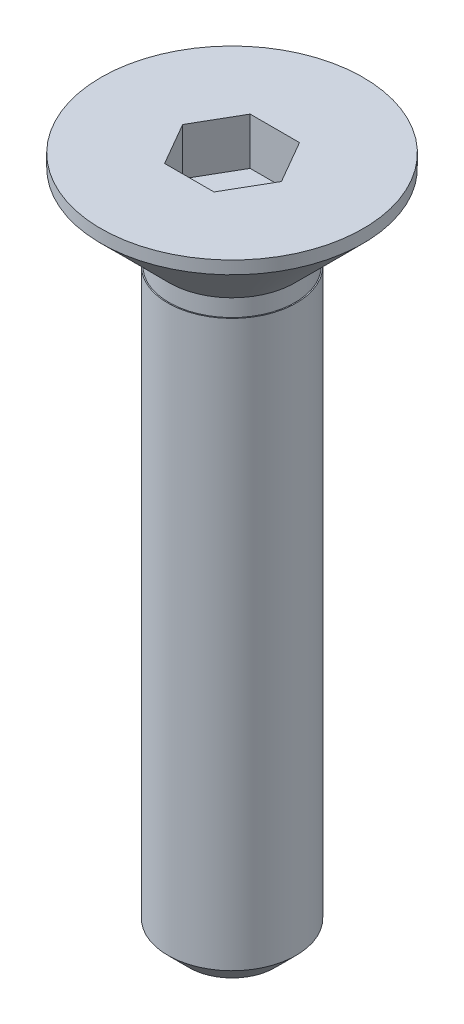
SolidWorks part; units mm, degrees
ref_plane "Plan de face" through (0, 0, 0) normal (0, 0, 1) x (1, 0, 0)
ref_plane "Plan de dessus" through (0, 0, 0) normal (0, 1, 0) x (1, 0, 0)
ref_plane "Plan de droite" through (0, 0, 0) normal (1, 0, 0) x (0, 0, -1)
sketch "Esquisse1" plane through (0, 0, 0) normal (0, 0, 1) x (1, 0, 0)
  line L0 (0, 0) -> (0, -13.71)
  line L1 (0, -13.71) -> (1, -13.71)
  line L2 (1.5, -13.21) -> (1.5, 0)
  line L4 (3.065, 2.29) -> (0, 2.29)
  line L6 (3.065, 2.29) -> (3.065, 1.99)
  line L7 (3.065, 1.99) -> (1.475, 0.4)
  line L8 (1.5, 0) -> (1.475, 0)
  line L9 (1.475, 0) -> (1.475, 0.4)
  line L10 (0, 2.29) -> (0, 0)
  line L11 (1, -13.71) -> (1.5, -13.21)
  point P4 (1.5, -13.71)
  dimension "D1" = 1.5
  dimension "D2" = 16
  dimension "D3" = 3.065
  dimension "D4" = 0.3
  dimension "D5" = 1.475
  dimension "D6" = 45
  dimension "D7" = 0.4
revolve "Révolution1" add sketch "Esquisse1" angle 360 about L10
sketch "Esquisse2" plane through (0, 2.29, 0) normal (0, 1, 0) x (1, 0, 0)
  line L1 (0.5774, -1) -> (1.1547, 0)
  line L2 (1.1547, 0) -> (0.5774, 1)
  line L3 (0.5774, 1) -> (-0.5774, 1)
  line L4 (-0.5774, 1) -> (-1.1547, 0)
  line L5 (-1.1547, 0) -> (-0.5774, -1)
  line L6 (-0.5774, -1) -> (0.5774, -1)
  circle A0 centre (0, 0) radius 1 construction
  dimension "D1" = 2
extrude "Enlèv. mat.-Extru.1" cut sketch "Esquisse2" against normal blind 1.1
